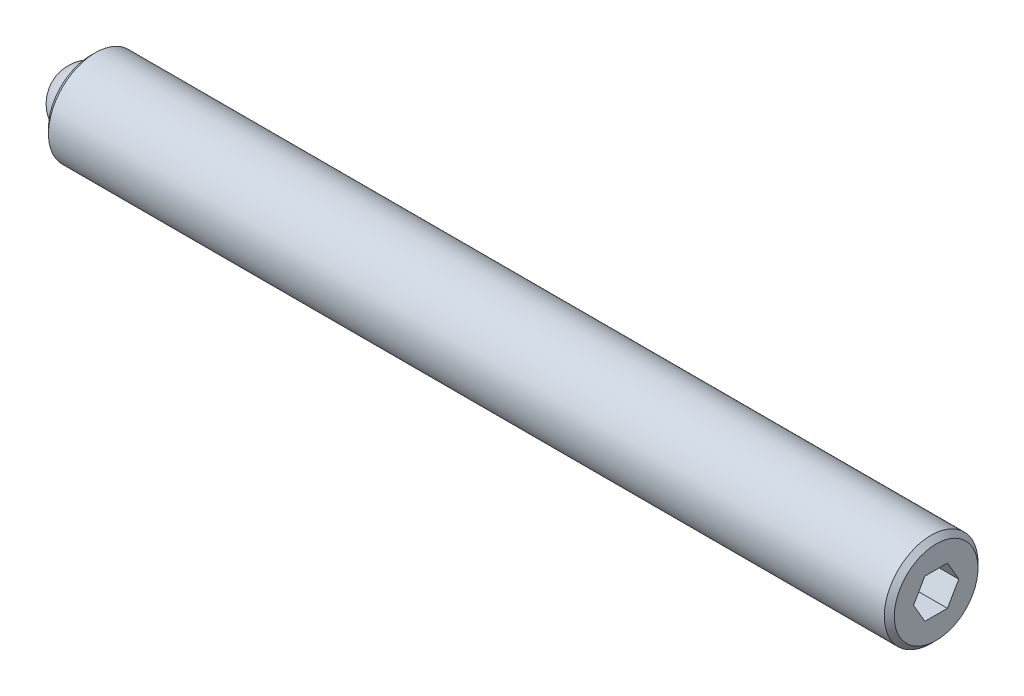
SolidWorks part; units mm, degrees
ref_plane "Front Plane" through (0, 0, 0) normal (0, 0, 1) x (1, 0, 0)
ref_plane "Top Plane" through (0, 0, 0) normal (0, 1, 0) x (1, 0, 0)
ref_plane "Right Plane" through (0, 0, 0) normal (1, 0, 0) x (0, 0, -1)
sketch "Sketch2" plane through (0, 0, 0) normal (1, 0, 0) x (0, 0, -1)
  circle A0 centre (0, 0) radius 2.3749
  dimension "D1" = 4.7498
extrude "Boss-Extrude1" add sketch "Sketch2" along normal blind 42.8625
sketch "Sketch3" plane through (0, 0, 0) normal (-1, 0, 0) x (0, 0, 1)
  circle A0 centre (0, 0) radius 1.5875
  dimension "D1" = 3.175
chamfer "Chamfer1" distance 0.254 angle 45 1 edges at (0, 0, -2.3749)
chamfer "Chamfer2" distance 0.254 angle 45 1 edges at (42.8625, 0, -2.3749)
sketch "Sketch4" plane through (42.8625, 0, 0) normal (1, 0, 0) x (0, 0, -1)
  line L1 (1.1457, 0) -> (0.5728, 0.9922)
  line L2 (0.5728, 0.9922) -> (-0.5728, 0.9922)
  line L3 (-0.5728, 0.9922) -> (-1.1457, 0)
  line L4 (-1.1457, 0) -> (-0.5728, -0.9922)
  line L5 (-0.5728, -0.9922) -> (0.5728, -0.9922)
  line L6 (0.5728, -0.9922) -> (1.1457, 0)
  circle A0 centre (0, 0) radius 0.9922 construction
extrude "Cut-Extrude2" cut sketch "Sketch4" against normal blind 2.286
extrude "Cut-Extrude3" cut sketch "Sketch3" against normal blind 1.5875
sketch "Sketch5" plane through (0, 0, 0) normal (-1, 0, 0) x (0, 0, 1)
  line L0 (0, 0) -> (0, -1.5875)
  line L1 (0, 0) -> (0, 1.5875)
  arc A0 (0, 1.5875) -> (0, -1.5875) centre (0, 0) ccw
revolve "Revolve1" add sketch "Sketch5" angle 360 about L1
